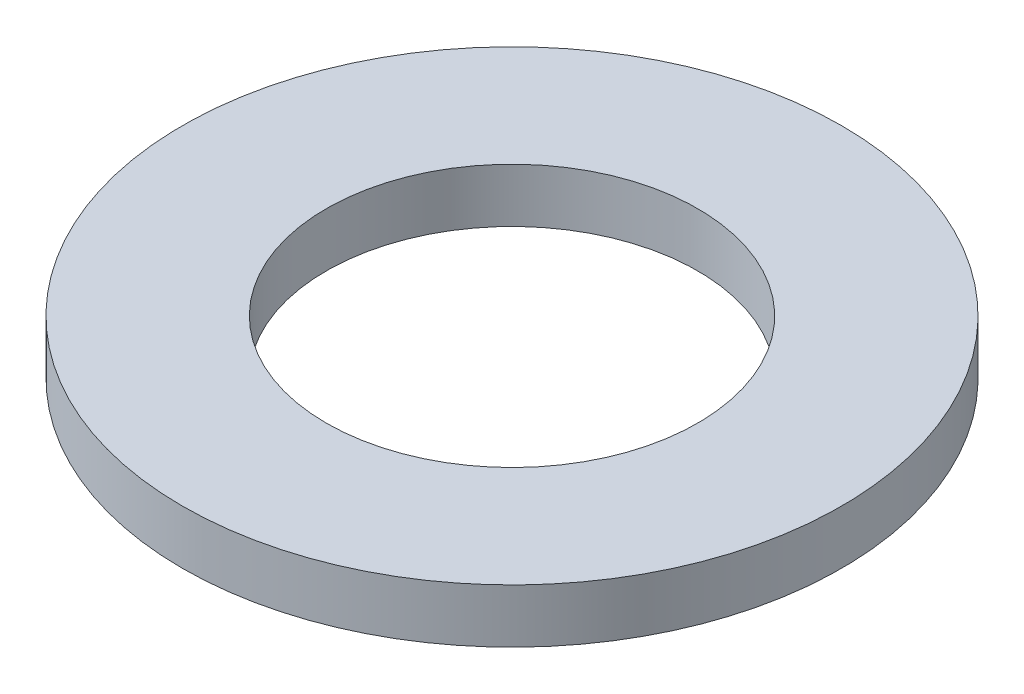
SolidWorks part; units mm, degrees
ref_plane "Front" through (0, 0, 0) normal (0, 0, 1) x (1, 0, 0)
ref_plane "Top" through (0, 0, 0) normal (0, 1, 0) x (1, 0, 0)
ref_plane "Right" through (0, 0, 0) normal (1, 0, 0) x (0, 0, -1)
sketch "Sketch1" plane through (0, 0, 0) normal (0, 1, 0) x (1, 0, 0)
  circle A0 centre (0, 0) radius 31
  circle A1 centre (0, 0) radius 55
extrude "Extrude1" add sketch "Sketch1" along normal blind 9
